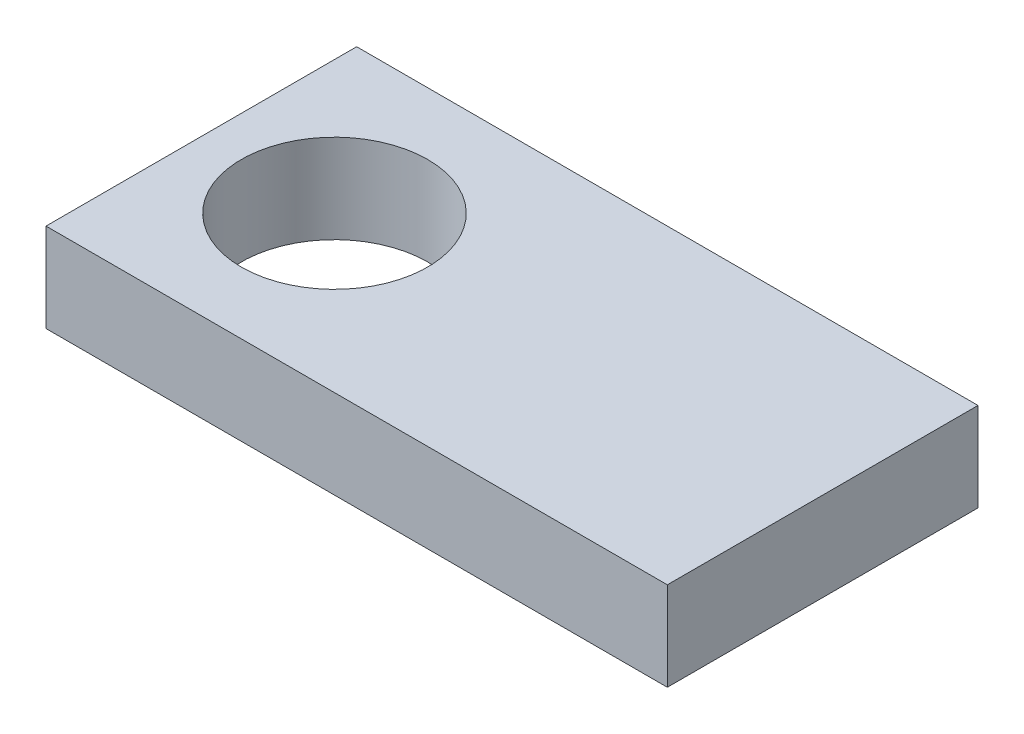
SolidWorks part; units mm, degrees
ref_plane "Face" through (0, 0, 0) normal (0, 0, 1) x (1, 0, 0)
ref_plane "Dessus" through (0, 0, 0) normal (0, 1, 0) x (1, 0, 0)
ref_plane "Droite" through (0, 0, 0) normal (1, 0, 0) x (0, 0, -1)
sketch "Esquisse1" plane through (0, 0, 0) normal (0, 0, 1) x (1, 0, 0)
  line L1 (0, 0) -> (140, 0)
  line L2 (0, 0) -> (0, 20)
  line L3 (0, 20) -> (140, 20)
  line L4 (140, 0) -> (140, 20)
  dimension "D1" = 140
  dimension "D2" = 20
extrude "Base-Extrusion" add sketch "Esquisse1" along normal blind 70
sketch "Esquisse2" plane through (0, 20, 0) normal (0, 1, 0) x (-1, 0, 0)
  line L0 (0, 35) -> (-140, 35) construction
  line L1 (0, 70) -> (0, 0) construction
  line L2 (-140, 70) -> (-140, 0) construction
  circle A0 centre (-30, 35) radius 21
  dimension "D1" = 42
  dimension "D2" = 30
extrude "Enlèv. mat.-Extru.1" cut sketch "Esquisse2" against normal through all
